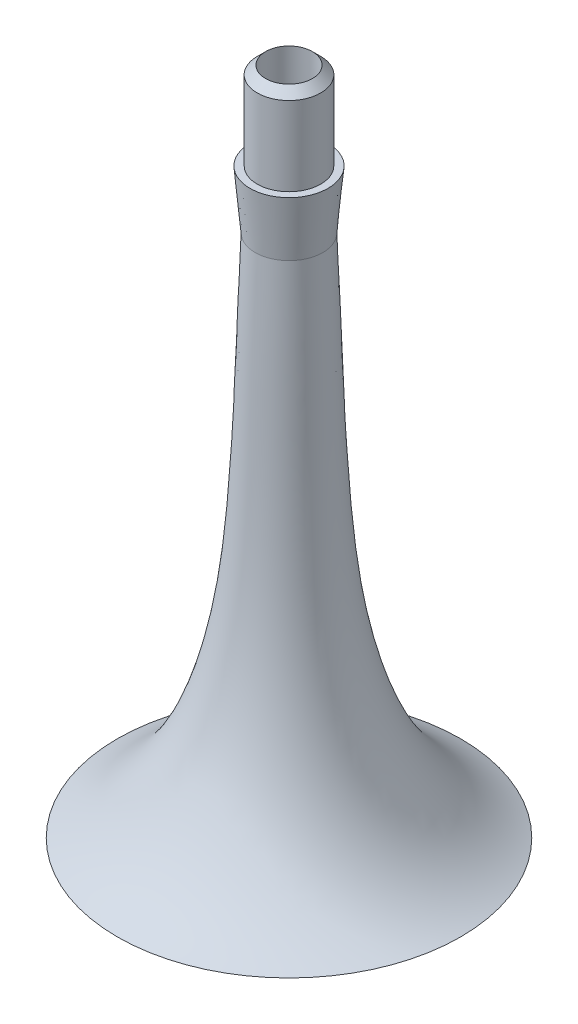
SolidWorks part; units mm, degrees
ref_plane "Front Plane" through (0, 0, 0) normal (0, 0, 1) x (1, 0, 0)
ref_plane "Top Plane" through (0, 0, 0) normal (0, 1, 0) x (1, 0, 0)
ref_plane "Right Plane" through (0, 0, 0) normal (1, 0, 0) x (0, 0, -1)
sketch "Sketch1" plane through (0, 0, 0) normal (0, 0, 1) x (1, 0, 0)
  line L1 (0, 0) -> (0, 50)
  line L2 (-59, 0) -> (-59, -2)
  line L3 (-59, -2) -> (0, -2)
  line L4 (0, -2) -> (0, 0)
  line L5 (0, 200) -> (0, 250)
  line L6 (0, 250) -> (-9.75, 250)
  line L7 (0, 50) -> (0, 100)
  line L9 (0, 100) -> (0, 150)
  line L11 (0, 150) -> (0, 200)
  spline S0 degree 3 poles (-59, 0) (-38.511, 9.6895) (-20.5431, 45.3749) (-14.2935, 99.7849) (-12.3808, 166.6664) (-9.9856, 216.6413) (-9.75, 250) knots 0 0 0 0 0.239706 0.431383 0.62099 1 1 1 1
  dimension "D1" = 59
  dimension "D2" = 50
  dimension "D3" = 2
  dimension "D4" = 50
  dimension "D5" = 9.75
  dimension "D6" = 50
  dimension "D8" = 50
  dimension "D10" = 50
revolve "Revolve-Thin3" add sketch "Sketch1" angle 360 about L9
sketch "Sketch5" plane through (0, 0, 0) normal (0, 0, 1) x (1, 0, 0)
  line L0 (0, 0) -> (0, 200)
  line L1 (-7.7657, 248) -> (-12.6502, 248)
  line L2 (-12.6502, 248) -> (-12.6502, 250.74)
  line L3 (-12.6502, 250.74) -> (0, 250)
  line L4 (9.75, 250) -> (-9.75, 250) construction
  line L5 (0, 250) -> (0, 200)
  line L6 (-59, 0) -> (-54.6364, 0)
  line L7 (0, 0) -> (0, -2)
  line L8 (-59, -2) -> (59, -2) construction
  line L9 (0, -2) -> (-59, -2)
  line L10 (-59, -2) -> (-59, 0)
  spline S0 degree 3 poles (-1691.0354, 1209.4679) (-0.3883, 835.4815) (2.7697, 508.953) (-9.9308, 172.0054) (-10.3569, 161.1524) (-11.1197, 139.4428) (-11.4532, 128.5861) (-12.2199, 112.312) (-12.5199, 106.888) (-13.2644, 96.0507) (-13.7055, 90.6464) (-15.4202, 74.5152) (-17.0891, 63.8706) (-20.4235, 50.8251) (-21.1514, 48.2287) (-22.7526, 43.0662) (-23.6269, 40.5003) (-25.5625, 35.4075) (-26.6236, 32.8806) (-28.9847, 27.8765) (-30.267, 25.4383) (-33.0665, 20.7181) (-34.5842, 18.435) (-37.0684, 15.1462) (-37.9311, 14.0726) (-39.732, 11.9747) (-40.6721, 10.9488) (-135.0787, -85.2702) (-497.476, 172.3853) (-1542.0883, 1325.1556) knots -3.505608 -3.505608 -3.505608 -3.505608 0.25 0.25 0.375 0.375 0.5 0.5 0.5625 0.5625 0.625 0.625 0.75 0.75 0.78125 0.78125 0.8125 0.8125 0.84375 0.84375 0.875 0.875 0.90625 0.90625 0.921875 0.921875 0.9375 0.9375 2.449166 2.449166 2.449166 2.449166 only from (-7.7657, 248) to (-54.6364, 0) construction
  spline S1 degree 3 poles (-7.7657, 248) (-7.9537, 226.2751) (-8.7035, 204.5661) (-9.9308, 172.0054) (-10.3569, 161.1524) (-11.1197, 139.4428) (-11.4532, 128.5861) (-12.2199, 112.312) (-12.5199, 106.888) (-13.2644, 96.0507) (-13.7055, 90.6464) (-15.4202, 74.5152) (-17.0891, 63.8706) (-20.4235, 50.8251) (-21.1514, 48.2287) (-22.7526, 43.0662) (-23.6269, 40.5003) (-25.5625, 35.4075) (-26.6236, 32.8806) (-28.9847, 27.8765) (-30.267, 25.4383) (-33.0665, 20.7181) (-34.5842, 18.435) (-37.0684, 15.1462) (-37.9311, 14.0726) (-39.732, 11.9747) (-40.6721, 10.9488) (-45.5013, 6.0269) (-49.8244, 2.6927) (-54.6364, 0) knots 0 0 0 0 0.25 0.25 0.375 0.375 0.5 0.5 0.5625 0.5625 0.625 0.625 0.75 0.75 0.78125 0.78125 0.8125 0.8125 0.84375 0.84375 0.875 0.875 0.90625 0.90625 0.921875 0.921875 0.9375 0.9375 1 1 1 1
  dimension "D1" = 200
revolve "Cut-Revolve3" cut sketch "Sketch5" angle 360 about L0
sketch "Sketch6" plane through (0, 0, 0) normal (0, 0, 1) x (1, 0, 0)
  line L3 (-8.8988, 230) -> (8.8988, 230)
  line L4 (8.8988, 230) -> (13.6264, 230)
  line L5 (13.6264, 230) -> (13.6264, 251.1485)
  line L6 (13.6264, 251.1485) -> (-13.403, 251.1485)
  line L8 (-13.403, 251.1485) -> (-13.403, 230)
  line L9 (-13.403, 230) -> (-8.8988, 230)
extrude "Cut-Extrude2" cut sketch "Sketch6" against normal through all both and the other way through all
sketch "Sketch7" plane through (0, 0, 0) normal (0, 0, 1) x (1, 0, 0)
  line L0 (10.9, 200) -> (13.4, 200)
  line L1 (0, 0) -> (0, 28.2678)
  line L2 (10.9, 200) -> (10.9, 230)
  line L3 (10.9, 230) -> (10.0401, 230)
  line L4 (13.4, 200) -> (11.6312, 180)
  spline S0 degree 3 poles (59, 0) (38.511, 9.6895) (20.5431, 45.3749) (14.2935, 99.7849) (12.5714, 160.0016) (10.6067, 203.3229) (10.0401, 230) knots 0 0 0 0 0.239706 0.431383 0.62099 0.924236 0.924236 0.924236 0.924236 construction
  spline S1 degree 3 poles (1536.0149, 1336.6646) (212.6449, -155.0305) (31.3601, -48.8008) (14.2935, 99.7849) (3.7356, 468.9552) (-54.1966, 819.0207) (1672.7532, 1219.9988) knots -1.074842 -1.074842 -1.074842 -1.074842 0.239706 0.431383 0.62099 4.436349 4.436349 4.436349 4.436349 only from (59, 0) to (10.0401, 230) construction
  spline S2 degree 3 poles (10.9, 200) (10.5553, 209.9981) (10.2526, 219.9975) (10.0401, 230) knots 0.810535 0.810535 0.810535 0.810535 0.924236 0.924236 0.924236 0.924236
  spline S3 degree 3 poles (59, 0) (38.511, 9.6895) (20.5431, 45.3749) (14.2935, 99.7849) (12.5714, 160.0016) (10.6067, 203.3229) (10.0401, 230) knots 0 0 0 0 0.239706 0.431383 0.62099 0.924236 0.924236 0.924236 0.924236 construction
  spline S4 degree 3 poles (1536.0149, 1336.6646) (212.6449, -155.0305) (31.3601, -48.8008) (14.2935, 99.7849) (3.7356, 468.9552) (-54.1966, 819.0207) (1672.7532, 1219.9988) knots -1.074842 -1.074842 -1.074842 -1.074842 0.239706 0.431383 0.62099 4.436349 4.436349 4.436349 4.436349 only from (59, 0) to (10.0401, 230) construction
  spline S5 degree 3 poles (11.6312, 180) (10.9992, 196.6637) (10.3942, 213.3275) (10.0401, 230) knots 0.734715 0.734715 0.734715 0.734715 0.924236 0.924236 0.924236 0.924236
  dimension "D1" = 2.5
revolve "Revolve1" add sketch "Sketch7" angle 360 about L1
sketch "Sketch8" plane through (0, 0, 0) normal (0, 0, 1) x (1, 0, 0)
  line L0 (-8.0397, 230) -> (-10.9, 227.1397)
  line L1 (-10.9, 230) -> (-10.9, 200) construction
  line L2 (-10.9, 230) -> (-11.4073, 229.4927)
  line L3 (-10.9, 230) -> (-8.0397, 230)
  line L4 (-11.4073, 229.4927) -> (-10.9, 227.1397)
  line L5 (0, 230) -> (0, 226.7367)
  line L6 (10.9, 230) -> (-10.9, 230) construction
revolve "Cut-Revolve4" cut sketch "Sketch8" angle 360 about L5
